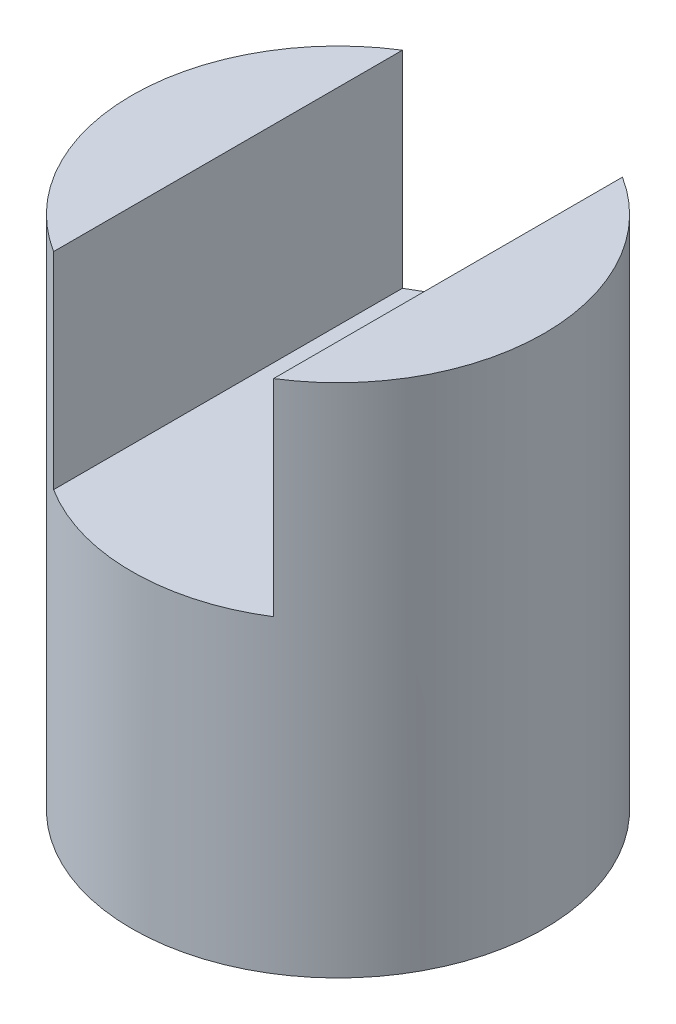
SolidWorks part; units mm, degrees
ref_plane "前视基准面" through (0, 0, 0) normal (0, 0, 1) x (1, 0, 0)
ref_plane "上视基准面" through (0, 0, 0) normal (0, 1, 0) x (1, 0, 0)
ref_plane "右视基准面" through (0, 0, 0) normal (1, 0, 0) x (0, 0, -1)
sketch "草图1" plane through (0, 0, 0) normal (0, 1, 0) x (1, 0, 0)
  circle A0 centre (0, 0) radius 30
  dimension "D1" = 60
extrude "拉伸1" add sketch "草图1" along normal blind 75
sketch "草图3" plane through (0, 75, 0) normal (0, 1, 0) x (1, 0, 0)
  line L0 (0, 0) -> (0, 66.573) construction
  line L1 (-16, 47.2951) -> (16, 47.2951)
  line L2 (-16, 47.2951) -> (-16, -52.1788)
  line L3 (-16, -52.1788) -> (16, -52.1788)
  line L4 (16, 47.2951) -> (16, -52.1788)
  line L5 (0, 66.573) -> (0, -57.8337) construction
  dimension "D1" = 32
extrude "切除-拉伸2" cut sketch "草图3" against normal blind 30
